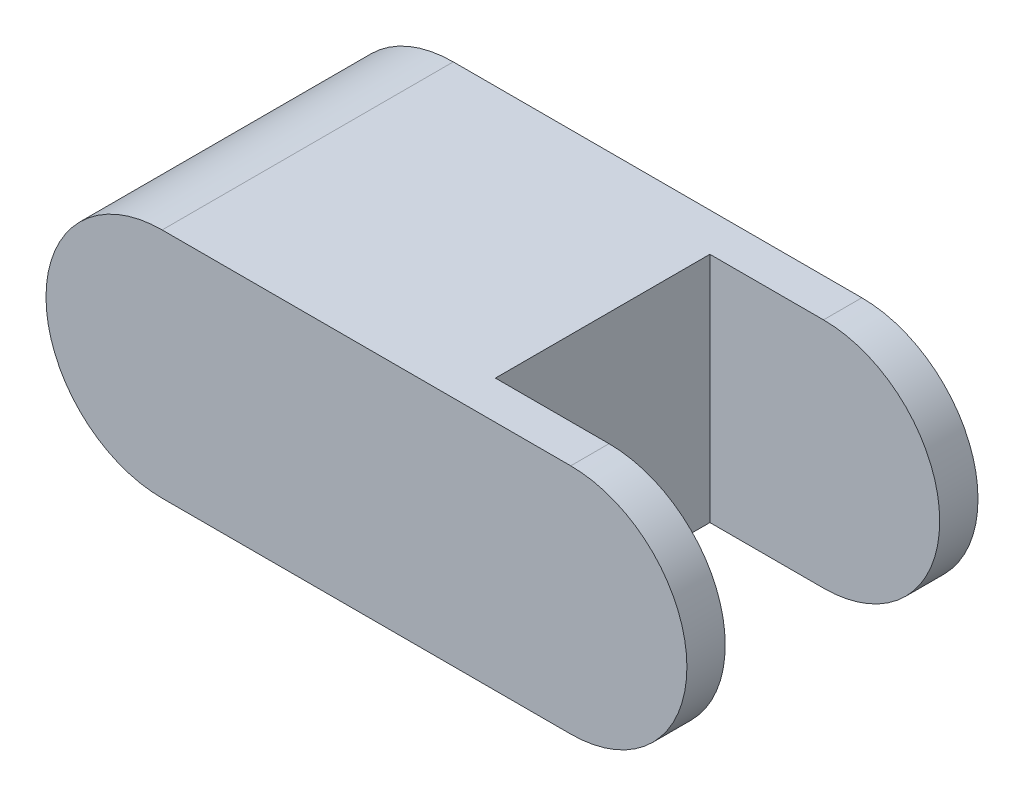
SolidWorks part; units mm, degrees
ref_plane "Front Plane" through (0, 0, 0) normal (0, 0, 1) x (1, 0, 0)
ref_plane "Top Plane" through (0, 0, 0) normal (0, 1, 0) x (1, 0, 0)
ref_plane "Right Plane" through (0, 0, 0) normal (1, 0, 0) x (0, 0, -1)
sketch "Sketch1" plane through (0, 0, 0) normal (0, 0, 1) x (1, 0, 0)
  line L0 (0, 78.8491) -> (0, -67.6383) construction
  line L1 (0, 0) -> (160, 0) construction
  line L2 (0, 45.5) -> (160, 45.5)
  line L3 (0, -45.5) -> (160, -45.5)
  arc A0 (0, 45.5) -> (0, -45.5) centre (0, 0) ccw
  arc A1 (160, -45.5) -> (160, 45.5) centre (160, 0) ccw
  dimension "D1" = 91
  dimension "D2" = 160
extrude "Boss-Extrude1" add sketch "Sketch1" against normal blind 114
sketch "Sketch2" plane through (0, 45.5, 0) normal (0, 1, 0) x (1, 0, 0)
  line L0 (205.5, 0) -> (205.5, 114) construction
  line L1 (205.5, 99) -> (115.5, 99)
  line L2 (205.5, 99) -> (205.5, 15)
  line L3 (205.5, 15) -> (115.5, 15)
  line L4 (115.5, 99) -> (115.5, 15)
  line L5 (205.5, 0) -> (205.5, 114) construction
  point P10 (205.5, 57)
  point P11 (205.5, 57)
  dimension "D1" = 90
  dimension "D2" = 84
extrude "Cut-Extrude1" cut sketch "Sketch2" against normal up to surface (91 mm away)
